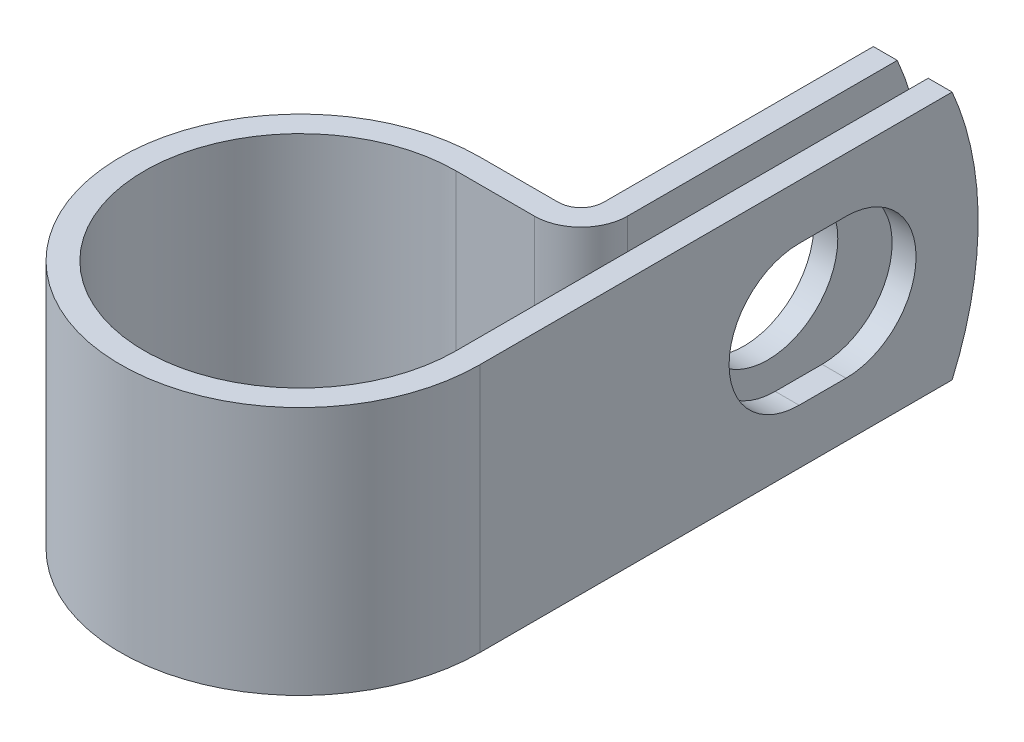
SolidWorks part; units mm, degrees
ref_plane "Front Plane" through (0, 0, 0) normal (0, 0, 1) x (1, 0, 0)
ref_plane "Top Plane" through (0, 0, 0) normal (0, 1, 0) x (1, 0, 0)
ref_plane "Right Plane" through (0, 0, 0) normal (1, 0, 0) x (0, 0, -1)
sketch "Sketch1" plane through (0, 0, 0) normal (0, 1, 0) x (1, 0, 0)
  line L0 (0, 7.9375) -> (3.9853, 7.9375)
  line L1 (7.9375, 0) -> (7.9375, 7.9375)
  line L2 (6.3627, 25.3746) -> (6.3627, 10.3149)
  line L5 (7.9375, 7.9375) -> (7.9375, 25.3746)
  arc A0 (0, 7.9375) -> (7.9375, 0) centre (0, 0) ccw
  arc A3 (3.9853, 7.9375) -> (6.3627, 10.3149) centre (3.9853, 10.3149) ccw
extrude "Extrude-Thin1" add sketch "Sketch1" along normal mid plane 12.7 thin
sketch "Sketch2" plane through (5.1435, 0, 0) normal (-1, 0, 0) x (0, 0, 1)
  line L0 (-25.3746, 6.35) -> (-25.3746, -6.35) construction
  line L7 (0, 6.35) -> (0, -6.35) construction
  circle A0 centre (-17.4498, 0) radius 3.5687
  point P2 (-25.3746, 0)
extrude "Cut-Extrude1" cut sketch "Sketch2" against normal up to surface (1.2192 mm away)
sketch "Sketch3" plane through (9.1567, 0, 0) normal (1, 0, 0) x (0, 0, -1)
  line L0 (16.256, 0) -> (18.6436, 0) construction
  line L1 (16.256, 3.5687) -> (18.6436, 3.5687)
  line L2 (16.256, -3.5687) -> (18.6436, -3.5687)
  line L3 (25.3746, 6.35) -> (25.3746, -6.35) construction
  arc A0 (16.256, 3.5687) -> (16.256, -3.5687) centre (16.256, 0) ccw
  arc A1 (18.6436, -3.5687) -> (18.6436, 3.5687) centre (18.6436, 0) ccw
  point P3 (17.4498, 0)
  point P8 (25.3746, 0)
  point P11 (12.6873, 0)
  point P12 (22.2123, 0)
extrude "Cut-Extrude2" cut sketch "Sketch3" against normal up to surface (1.2192 mm away)
sketch "Sketch4" plane through (5.1435, 0, 0) normal (-1, 0, 0) x (0, 0, 1)
  line L0 (-25.3746, 6.35) -> (-25.3746, -6.35)
  line L1 (-25.3746, 6.35) -> (-24.0493, 6.35)
  line L2 (-25.3746, 6.35) -> (-10.3149, 6.35) construction
  line L3 (-25.3746, -6.35) -> (-24.0493, -6.35)
  line L4 (-25.3746, -6.35) -> (-10.3149, -6.35) construction
  arc A0 (-24.0493, 6.35) -> (-24.0493, -6.35) centre (-9.4996, 0) ccw
extrude "Cut-Extrude3" cut sketch "Sketch4" against normal through all contours A0 M4 M5 | A0 L0 M2
equation "\"D1@Sketch3\" = \"D2@Sketch2\""
equation "\"D7@Sketch1\" = \"D3@Sketch2\" + \"D1@Sketch3\""
equation "\"D1@Sketch4\" = ( \"D1@Extrude-Thin1\" + .125 ) * 2"
equation "\"D2@Sketch1\"=1.95*\"D5@Extrude-Thin1\""
equation "\"D2@Sketch3\" = \"D1@Sketch2\""
